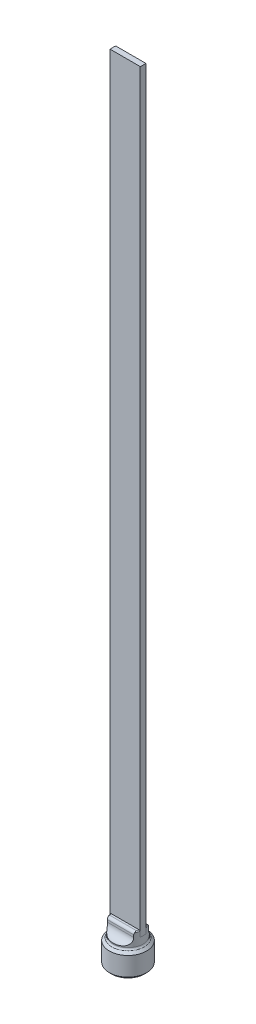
SolidWorks part; units mm, degrees
ref_plane "Front Plane" through (0, 0, 0) normal (0, 0, 1) x (1, 0, 0)
ref_plane "Top Plane" through (0, 0, 0) normal (0, 1, 0) x (1, 0, 0)
ref_plane "Right Plane" through (0, 0, 0) normal (1, 0, 0) x (0, 0, -1)
imported_body "Imported1"
sketch "Sketch1" plane through (0, 8.4582, 0) normal (0, 1, 0) x (1, 0, 0)
  line L0 (-3.8699, 0.7239) -> (3.8699, 0.7239)
  line L1 (3.8699, -0.7239) -> (-3.8699, -0.7239)
  line L2 (3.8182, 0.7239) -> (-3.8182, 0.7239) construction
  line L3 (-3.8182, -0.7239) -> (3.8182, -0.7239) construction
  arc A0 (3.8699, -0.7239) -> (3.8699, 0.7239) centre (0, 0) ccw
  arc A1 (-3.8699, 0.7239) -> (-3.8699, -0.7239) centre (0, 0) ccw
  dimension "D1" = 7.874
extrude "Boss-Extrude1" add sketch "Sketch1" along normal offset from surface (194.7418 mm away) 203.2
